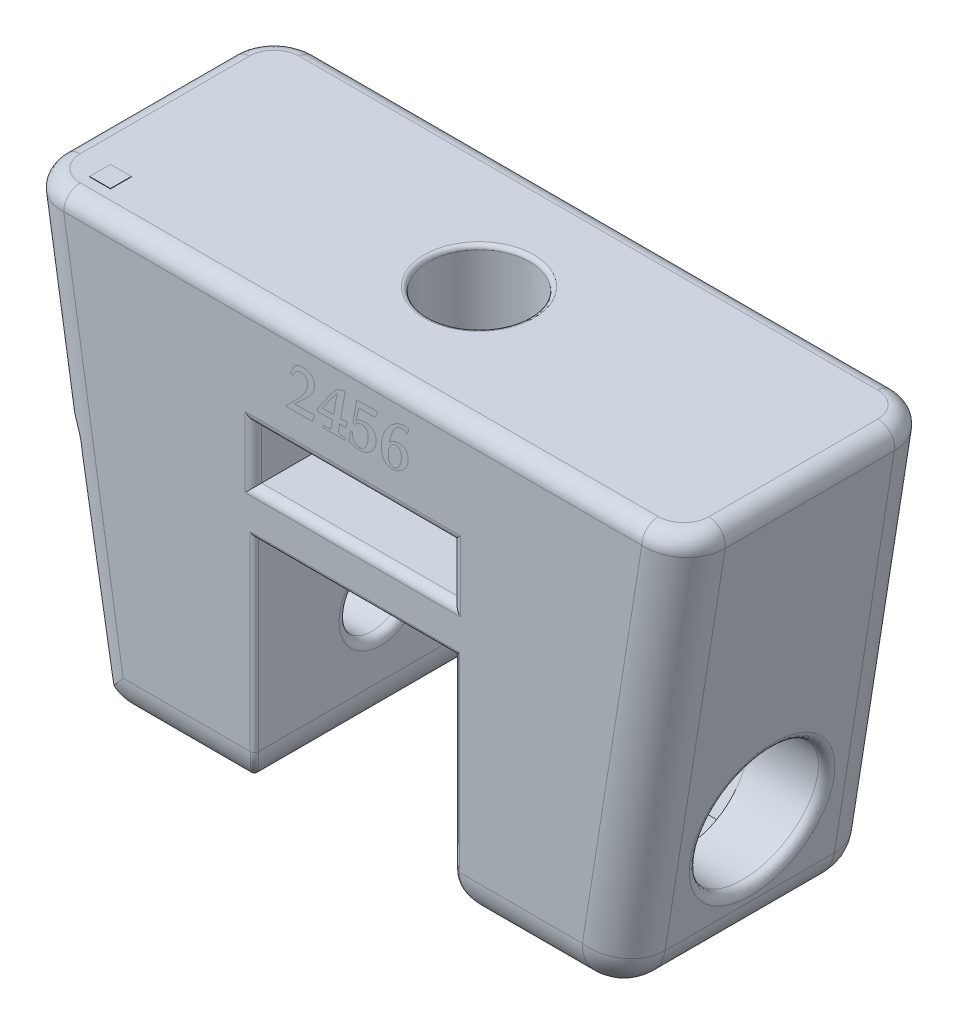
SolidWorks part; units mm, degrees
ref_plane "Front Plane" through (0, 0, 0) normal (0, 0, 1) x (1, 0, 0)
ref_plane "Top Plane" through (0, 0, 0) normal (0, 1, 0) x (1, 0, 0)
ref_plane "Right Plane" through (0, 0, 0) normal (1, 0, 0) x (0, 0, -1)
sketch "Sketch1" plane through (0, 0, 0) normal (0, 0, 1) x (1, 0, 0)
  line L0 (-18.2636, 0) -> (22.5034, 0)
  line L1 (22.5034, 0) -> (18.3124, -26.4158)
  line L2 (-18.2636, 0) -> (-14.0726, -26.4158)
  line L3 (-14.0726, -26.4158) -> (18.3124, -26.4158)
  dimension "D1" = 40.767
  dimension "D2" = 26.7462
  dimension "D3" = 26.7462
  dimension "D4" = 32.385
extrude "Boss-Extrude1" add sketch "Sketch1" along normal blind 15.4178
sketch "Sketch2" plane through (0, 0, 15.4178) normal (0, 0, 1) x (1, 0, 0)
  line L0 (-14.0726, -26.4158) -> (18.3124, -26.4158) construction
  line L1 (-3.8872, -12.4966) -> (8.381, -12.4966)
  line L2 (-3.8872, -12.4966) -> (-3.8872, -26.4158)
  line L3 (-3.8872, -26.4158) -> (8.381, -26.4158)
  line L4 (8.381, -12.4966) -> (8.381, -26.4158)
  line L5 (-14.651, -13.2132) -> (-12.2946, -26.4158)
  line L7 (-18.2636, 0) -> (-14.0726, -26.4158) construction
  line L8 (-16.4227, -11.6034) -> (-14.0726, -26.4158)
  line L9 (-14.0726, -26.4158) -> (-12.2946, -26.4158)
  line L10 (22.5034, 0) -> (-18.2636, 0) construction
  line L11 (-3.9507, -6.5532) -> (8.1905, -6.5532)
  line L12 (-3.9507, -6.5532) -> (-3.9507, -9.8298)
  line L13 (-3.9507, -9.8298) -> (8.1905, -9.8298)
  line L14 (8.1905, -6.5532) -> (8.1905, -9.8298)
  line L15 (2.1199, 0) -> (2.1199, -28.2356) construction
  arc A0 (-16.4227, -11.6034) -> (-14.651, -13.2132) centre (-16.2666, -13.2114) cw
  dimension "D1" = 12.2682
  dimension "D2" = 13.9192
  dimension "D3" = 9.9314
  dimension "D4" = 13.4112
  dimension "D5" = 1.778
  dimension "D6" = 12.1412
  dimension "D7" = 3.2766
  dimension "D8" = 6.5532
extrude "Cut-Extrude1" cut sketch "Sketch2" against normal blind 15.4178
fillet "Fillet1" radius 2.54 1 edges at (-17.3431, -5.8017, 15.4178)
fillet "Fillet2" radius 2.54 3 edges at (-17.3431, -5.8017, 0) (20.4079, -13.2079, 0) (20.4079, -13.2079, 15.4178)
sketch "Sketch4" plane through (0, 0, 0) normal (0, 1, 0) x (1, 0, 0)
  line L0 (2.1199, 0) -> (2.1199, -15.4178) construction
  line L1 (19.9316, 0) -> (-15.6918, 0) construction
  line L2 (19.9316, -15.4178) -> (-15.6918, -15.4178) construction
  circle A0 centre (2.1199, -7.7089) radius 3.0988
  dimension "D1" = 6.1976
extrude "Cut-Extrude2" cut sketch "Sketch4" against normal blind 8.0518
sketch "Sketch5" plane through (-3.8872, 0, 0) normal (1, 0, 0) x (0, 0, -1)
  line L0 (-7.7089, -26.4158) -> (-7.7089, -12.4966) construction
  line L1 (0, -26.4158) -> (-15.4178, -26.4158) construction
  line L2 (0, -12.4966) -> (-15.4178, -12.4966) construction
  line L3 (-15.4178, -19.4562) -> (0, -19.4562) construction
  line L4 (-15.4178, -12.4966) -> (-15.4178, -26.4158) construction
  line L5 (0, -12.4966) -> (0, -26.4158) construction
  circle A0 centre (-7.7089, -19.4562) radius 2.032
  dimension "D1" = 4.064
extrude "Cut-Extrude3" cut sketch "Sketch5" against normal blind 12.6238
sketch "Sketch6" plane through (8.381, 0, 0) normal (-1, 0, 0) x (0, 0, 1)
  line L0 (7.7089, -12.4966) -> (7.7089, -26.4158) construction
  line L1 (0, -12.4966) -> (15.4178, -12.4966) construction
  line L2 (0, -26.4158) -> (15.4178, -26.4158) construction
  line L3 (15.4178, -19.4562) -> (0, -19.4562) construction
  line L4 (15.4178, -26.4158) -> (15.4178, -12.4966) construction
  line L5 (0, -26.4158) -> (0, -12.4966) construction
  line L7 (5.3666, -23.2838) -> (9.8525, -23.3985)
  line L8 (9.8525, -23.3985) -> (12.1948, -19.571)
  line L9 (12.1948, -19.571) -> (10.0512, -15.6287)
  line L10 (10.0512, -15.6287) -> (5.5653, -15.5139)
  line L11 (5.5653, -15.5139) -> (3.223, -19.3415)
  line L12 (3.223, -19.3415) -> (5.3666, -23.2838)
  circle A0 centre (7.7089, -19.4562) radius 3.8862 construction
  dimension "D1" = 7.7724
extrude "Cut-Extrude4" cut sketch "Sketch6" against normal blind 6.35
sketch "Sketch7" plane through (14.731, 0, 0) normal (-1, 0, 0) x (0, 0, 1)
  circle A0 centre (7.7089, -19.4562) radius 3.8862
extrude "Cut-Extrude5" cut sketch "Sketch7" against normal blind 6.35
fillet "Fillet3" radius 2.54 9 edges at (12.0608, -26.4158, 15.4178) (17.5591, -26.4158, 14.6739) (18.3124, -26.4158, 7.7089) (17.5591, -26.4158, 0.7439) (-7.694, -26.4158, 15.4178) (-3.8872, -26.4158, 7.7089) (-7.694, -26.4158, 0) (8.381, -26.4158, 7.7089) (12.0608, -26.4158, 0)
fillet "Fillet5" radius 2.54 1 edges at (-12.2946, -26.4158, 7.7089)
sketch "Sketch8" plane through (0, 0, 0) normal (0, 1, 0) x (1, 0, 0)
  line L0 (-15.001, -15.4178) -> (-15.001, 0) construction
  line L1 (19.9316, -15.4178) -> (-15.6918, -15.4178) construction
  line L2 (19.9316, 0) -> (-15.6918, 0) construction
  line L4 (-15.5666, -13.8064) -> (-14.2896, -13.8064)
  line L5 (-15.5666, -13.8064) -> (-15.5666, -12.5307)
  line L6 (-15.5666, -12.5307) -> (-14.2896, -12.5307)
  line L7 (-14.2896, -13.8064) -> (-14.2896, -12.5307)
extrude "Boss-Extrude2" add sketch "Sketch8" along normal blind 0.0254
sketch "Sketch9" plane through (0, 0, 0) normal (0, 1, 0) x (1, 0, 0)
  line L0 (-14.9281, -13.8064) -> (-14.9281, 0) construction
  line L1 (-15.5666, -13.8064) -> (-14.2896, -13.8064) construction
  line L2 (19.9316, 0) -> (-15.6918, 0) construction
  line L3 (-19.364, -13.1655) -> (23.2318, -13.1655) construction
fillet "Fillet6" radius 1.016 8 edges at (21.7501, 0, 14.6739) (22.5034, 0, 7.7089) (21.7501, 0, 0.7439) (2.1199, 0, 0) (-17.5104, 0, 0.7439) (-18.2636, 0, 7.7089) (-17.5104, 0, 14.6739) (2.1199, 0, 15.4178)
fillet "Fillet7" radius 0.508 11 edges at (-13.1741, -21.4882, 7.7089) (-3.8872, -17.4242, 7.7089) (18.8, -23.3424, 7.7089) (8.1905, -8.1915, 0) (2.1199, -9.8298, 0) (2.1199, -6.5532, 0) (-3.9507, -8.1915, 0) (8.1905, -8.1915, 15.4178) (2.1199, -9.8298, 15.4178) (-3.9507, -8.1915, 15.4178) (2.1199, -6.5532, 15.4178)
fillet "Fillet8" radius 0.254 18 edges at (2.1199, 0, 10.8077) (-0.9789, -6.5532, 7.7089) (9.1249, -25.6719, 14.6739) (-4.6312, -25.6719, 14.6739) (-4.6312, -25.6719, 0.7439) (9.1249, -25.6719, 0.7439) (8.381, -18.1862, 15.4178) (-3.8872, -18.1862, 15.4178) (-3.8872, -18.1862, 0) (8.381, -18.1862, 0) (8.381, -21.3126, 4.2948) (8.381, -23.3411, 7.6095) (8.381, -21.4847, 11.0237) (8.381, -17.5998, 11.123) (8.381, -15.5713, 7.8083) (8.381, -17.4277, 4.3941) (2.2469, -12.4966, 0) (2.2469, -12.4966, 15.4178)
ref_plane "Plane1" through (0, 0, 17.9578) normal (0, 0, 1) x (1, 0, 0)
sketch "Sketch10" plane through (0, 0, 17.9578) normal (0, 0, 1) x (1, 0, 0)
  line L0 (-7.9668, -4.5224) -> (11.6512, -4.5224) construction
  text T0 "<b><i>2456</i></b>" font "Palatino Linotype" height in points 10
